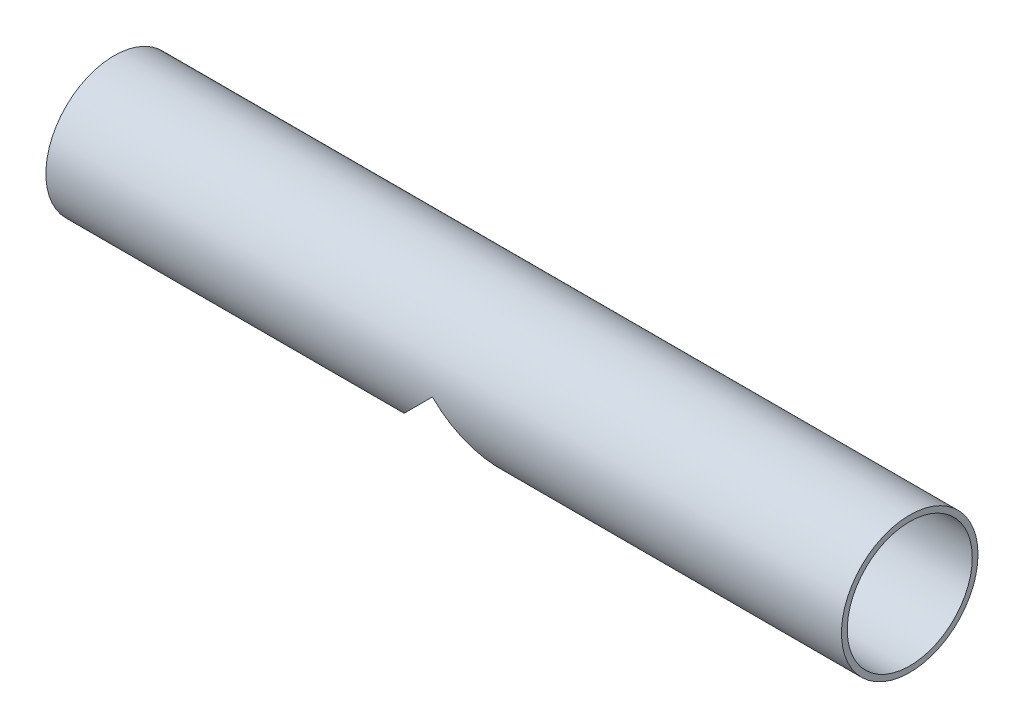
SolidWorks part; units mm, degrees
ref_plane "Plan de face" through (0, 0, 0) normal (0, 0, 1) x (1, 0, 0)
ref_plane "Plan de dessus" through (0, 0, 0) normal (0, 1, 0) x (1, 0, 0)
ref_plane "Plan de droite" through (0, 0, 0) normal (1, 0, 0) x (0, 0, -1)
sketch "Esquisse1" plane through (0, 0, 0) normal (0, 0, 1) x (1, 0, 0)
  line L0 (0, 0) -> (443.5, 0)
  dimension "D1" = 443.5
ref_plane "Plan1" through (0, 0, 0) normal (1, 0, 0) x (0, 0, -1)
sketch "Esquisse2" plane through (0, 0, 0) normal (1, 0, 0) x (0, 0, -1)
  circle A0 centre (0, 0) radius 34.85
  circle A1 centre (0, 0) radius 38.05
  dimension "D1" = 76.1
  dimension "D2" = 3.2
sweep "Balayage1" add profiles "Esquisse2" path "Esquisse1"
sketch "Esquisse3" plane through (0, 0, 0) normal (0, 0, 1) x (1, 0, 0)
  line L0 (215.4524, 0) -> (170.5912, -44.8612)
  line L1 (170.5912, -44.8612) -> (260.3136, -44.8612)
  line L2 (215.4524, 0) -> (260.3136, -44.8612)
  line L3 (215.4524, 0) -> (215.4524, -20.9542) construction
extrude "Enlèv. mat.-Extru.1" cut sketch "Esquisse3" against normal mid plane 80
